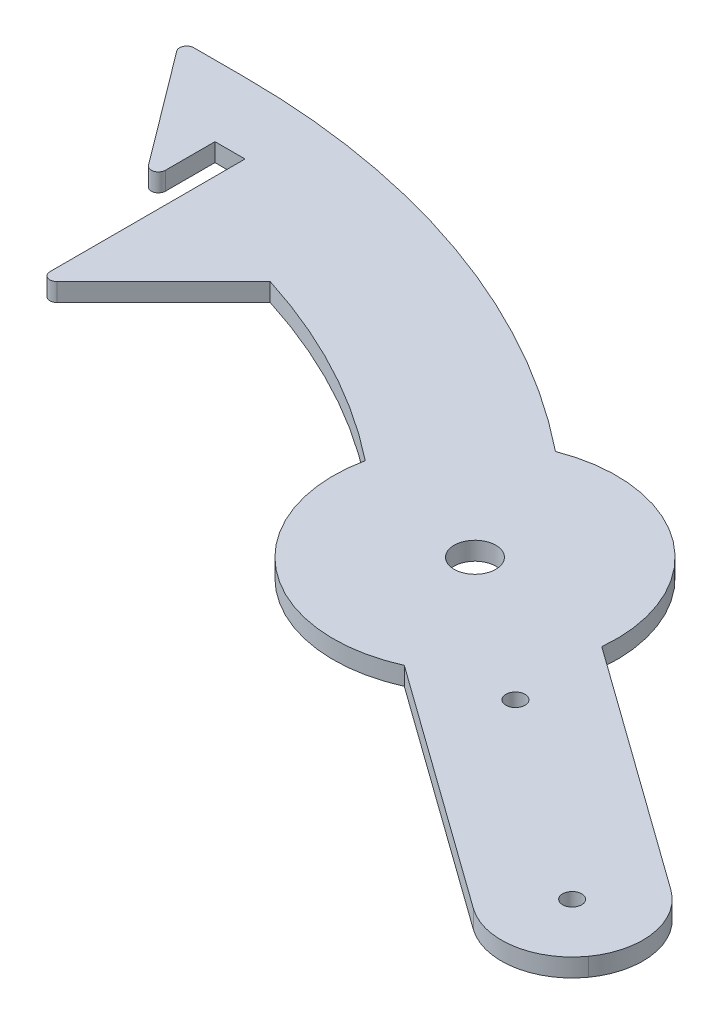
SolidWorks part; units mm, degrees
ref_plane "Front Plane" through (0, 0, 0) normal (0, 0, 1) x (1, 0, 0)
ref_plane "Top Plane" through (0, 0, 0) normal (0, 1, 0) x (1, 0, 0)
ref_plane "Right Plane" through (0, 0, 0) normal (1, 0, 0) x (0, 0, -1)
sketch "Sketch1" plane through (0, 0, 0) normal (0, 1, 0) x (1, 0, 0)
  line L0 (-213.995, 107.95) -> (-175.895, 57.15)
  line L3 (-165.1, 48.9677) -> (-165.1, 6.35)
  line L6 (-213.995, 107.95) -> (-190.9159, 107.95)
  line L8 (129.5983, -124.3474) -> (159.2317, -83.086)
  line L9 (159.2317, -83.086) -> (50.5501, -5.0325)
  line L10 (-170.4975, 82.55) -> (-170.4975, -82.55) construction
  line L11 (-170.4975, 0) -> (473.399, 0) construction
  line L13 (-122.4823, 48.9677) -> (-165.1, 48.9677) construction
  line L15 (-175.895, 82.55) -> (-165.1, 82.55)
  line L16 (-165.1, 82.55) -> (-165.1, 48.9677)
  line L17 (-175.895, 82.55) -> (-175.895, 57.15)
  line L18 (0, 0) -> (144.415, -103.7167) construction
  line L19 (20.9168, -46.2939) -> (129.5983, -124.3474)
  line L20 (-165.1, 6.35) -> (-122.4823, 48.9677)
  arc A0 (-190.9159, 107.95) -> (-18.4333, 47.3377) centre (-190.9159, -167.7703) cw
  circle A3 centre (0, 0) radius 7.493
  circle A4 centre (123.7843, -88.9) radius 3.429
  arc A5 (-49.7347, 10.3487) -> (20.9168, -46.2939) centre (0, 0) ccw
  arc A6 (50.5501, -5.0325) -> (-18.4333, 47.3377) centre (0, 0) ccw
  circle A7 centre (0, 0) radius 63.5 construction
  circle A8 centre (51.5768, -37.0417) radius 3.429
  arc A9 (-122.4823, 48.9677) -> (-49.7347, 10.3487) centre (-190.9159, -167.7703) cw
  dimension "D8" = 38.1
  dimension "D9" = 25.4
  dimension "D14" = 14.986
  dimension "D15" = 50.8
  dimension "D10" = 25.4
  dimension "D12" = 6.858
  dimension "D3" = 101.6
  dimension "D16" = 275.7203
  dimension "D17" = 45
  dimension "D18" = 127
  dimension "D19" = 6.858
  dimension "D22" = 227.2851
  dimension "D4" = 165.1
  dimension "D5" = 25.4
  dimension "D6" = 10.795
  dimension "D7" = 165.1
  dimension "D11" = 88.9
  dimension "D13" = 6.35
  dimension "D20" = 18.4333
  dimension "D21" = 152.4
extrude "Boss-Extrude1" add sketch "Sketch1" along normal blind 6.5278
fillet "Fillet1" radius 2.54 3 edges at (-175.895, 3.2639, -57.15) (-213.995, 3.2639, -107.95) (-165.1, 3.2639, -6.35)
fillet "Fillet2" radius 25.4 2 edges at (159.2317, 3.2639, 83.086) (129.5983, 3.2639, 124.3474)
